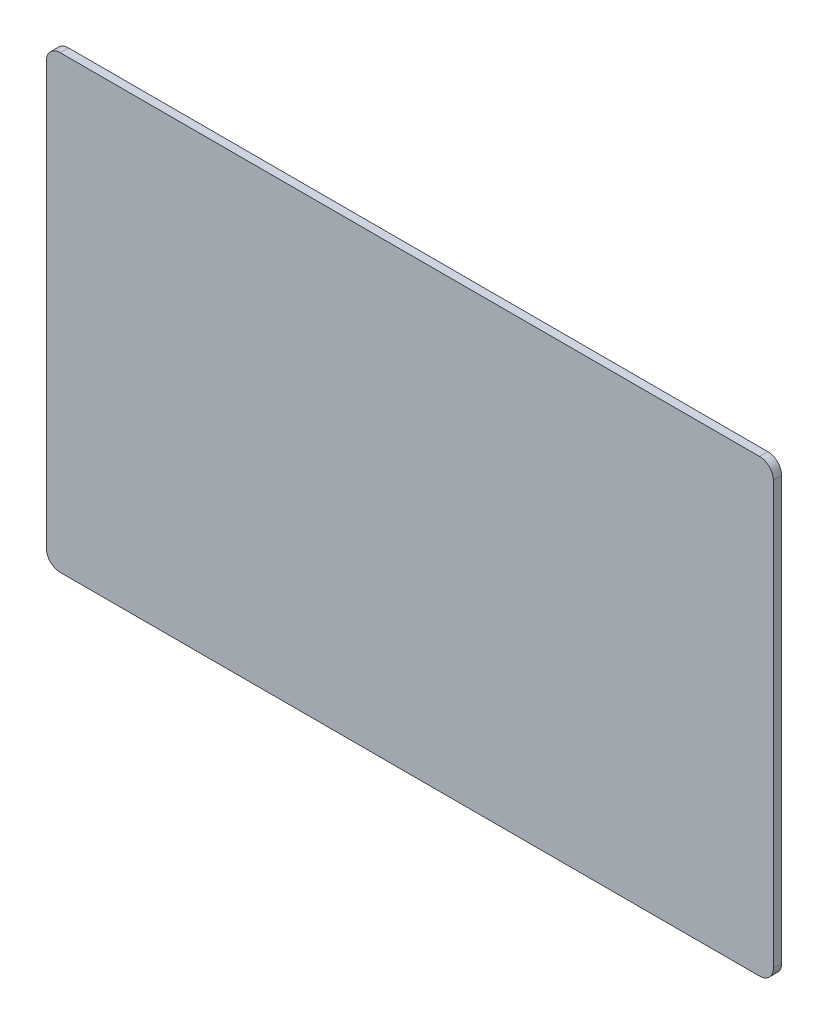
SolidWorks part; units mm, degrees
ref_plane "Alzado" through (0, 0, 0) normal (0, 0, 1) x (1, 0, 0)
ref_plane "Planta" through (0, 0, 0) normal (0, 1, 0) x (1, 0, 0)
ref_plane "Vista lateral" through (0, 0, 0) normal (1, 0, 0) x (0, 0, -1)
sketch "Croquis1" plane through (0, 0, 0) normal (0, 0, 1) x (1, 0, 0)
  line L1 (-52.5, -32.5) -> (52.5, -32.5)
  line L2 (-52.5, -32.5) -> (-52.5, 32.5)
  line L3 (-52.5, 32.5) -> (52.5, 32.5)
  line L4 (52.5, -32.5) -> (52.5, 32.5)
  line L5 (-52.5, -32.5) -> (52.5, 32.5) construction
  line L6 (-52.5, 32.5) -> (52.5, -32.5) construction
  point P0 (0, 0)
  dimension "D1" = 65
  dimension "D2" = 105
extrude "Saliente-Extruir1" add sketch "Croquis1" along normal blind 1.2
fillet "Redondeo1" radius 2 4 edges at (52.5, 32.5, 0.6) (-52.5, 32.5, 0.6) (-52.5, -32.5, 0.6) (52.5, -32.5, 0.6)
sketch "Croquis2" plane through (0, 0, 0) normal (0, 0, -1) x (-1, 0, 0)
  line L0 (-52.5, -30.5) -> (-52.5, 30.5) construction
  line L1 (-25.5, -10.5) -> (25.5, -10.5)
  line L2 (-25.5, -10.5) -> (-25.5, 21.5)
  line L3 (-25.5, 21.5) -> (25.5, 21.5)
  line L4 (25.5, -10.5) -> (25.5, 21.5)
  line L5 (52.5, 30.5) -> (52.5, -30.5) construction
  line L6 (-50.5, 32.5) -> (50.5, 32.5) construction
  line L8 (50.5, -32.5) -> (-50.5, -32.5) construction
  point P0 (0, 0)
  dimension "D1" = 27
  dimension "D2" = 27
  dimension "D3" = 11
  dimension "D4" = 22
sketch "Croquis3" plane through (0, 0, 0) normal (0, 0, -1) x (-1, 0, 0)
  line L0 (-52.5, -30.5) -> (-52.5, 30.5) construction
  line L1 (-5.5, -27.8) -> (5.5, -27.8)
  line L2 (-5.5, -27.8) -> (-5.5, -22.6)
  line L3 (-5.5, -22.6) -> (5.5, -22.6)
  line L4 (5.5, -27.8) -> (5.5, -22.6)
  line L5 (-5.5, -27.8) -> (5.5, -22.6) construction
  line L6 (-5.5, -22.6) -> (5.5, -27.8) construction
  line L7 (52.5, 30.5) -> (52.5, -30.5) construction
  line L8 (50.5, -32.5) -> (-50.5, -32.5) construction
  point P0 (0, -25.2)
  dimension "D1" = 47
  dimension "D2" = 47
  dimension "D3" = 4.7
  dimension "D4" = 5.2
extrude "Saliente-Extruir2" add sketch "Croquis3" along normal blind 1.6
sketch "Croquis4" plane through (0, 0, 0) normal (0, 0, -1) x (-1, 0, 0)
  line L0 (50.5, -32.5) -> (-50.5, -32.5) construction
  line L1 (-45.2, 21.5) -> (-40.2, 21.5)
  line L2 (-45.2, 21.5) -> (-45.2, 8.5)
  line L3 (-45.2, 8.5) -> (-40.2, 8.5)
  line L4 (-40.2, 21.5) -> (-40.2, 8.5)
  line L5 (-45.2, 21.5) -> (-40.2, 8.5) construction
  line L6 (-45.2, 8.5) -> (-40.2, 21.5) construction
  line L7 (-50.5, 32.5) -> (50.5, 32.5) construction
  line L8 (-52.5, -30.5) -> (-52.5, 30.5) construction
  point P0 (-42.7, 15)
  point P5 (-42.7, 8.5)
  dimension "D1" = 41
  dimension "D2" = 11
  dimension "D3" = 5
  dimension "D4" = 7.3
